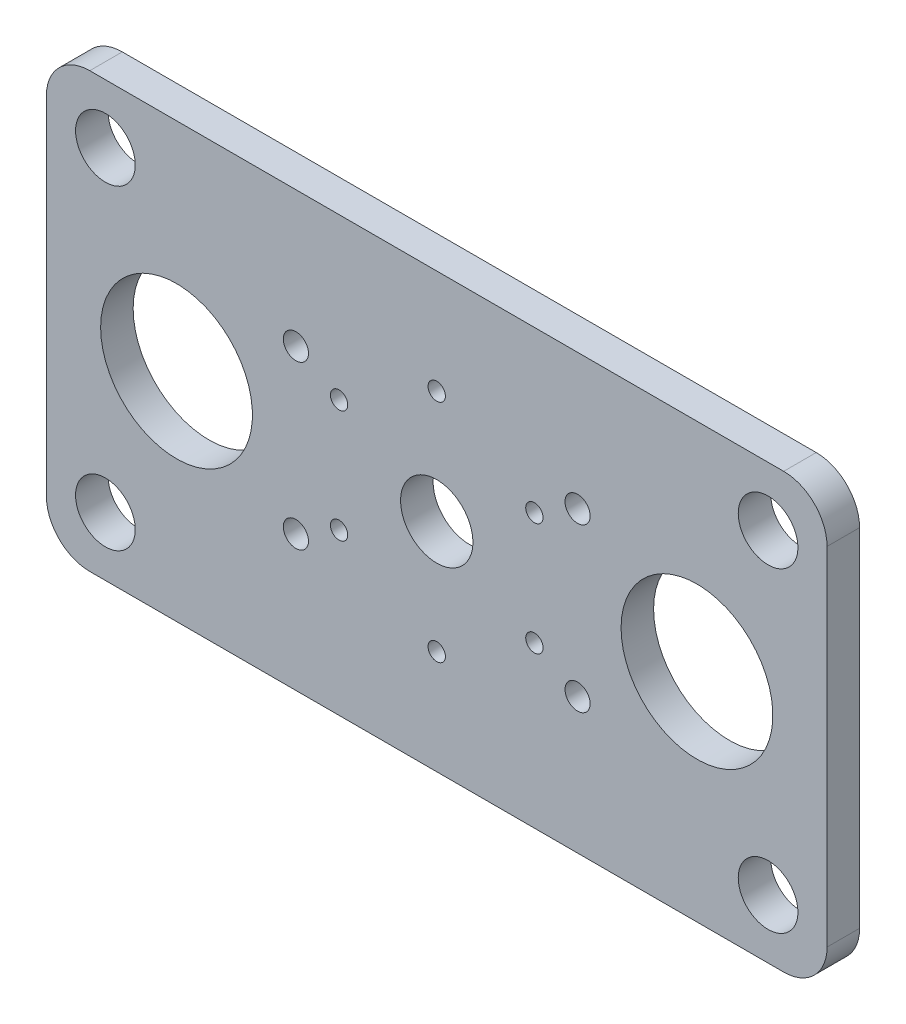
SolidWorks part; units mm, degrees
ref_plane "Front Plane" through (0, 0, 0) normal (0, 0, 1) x (1, 0, 0)
ref_plane "Top Plane" through (0, 0, 0) normal (0, 1, 0) x (1, 0, 0)
ref_plane "Right Plane" through (0, 0, 0) normal (1, 0, 0) x (0, 0, -1)
imported_body "Imported1"
sketch "Sketch1" plane through (0, 0, 4.7625) normal (0, 0, 1) x (1, 0, 0)
  circle A0 centre (0, 16.51) radius 1.27
  circle A1 centre (0, 0) radius 5.2959 construction
  circle A2 centre (14.2981, 8.255) radius 1.27
  circle A3 centre (14.2981, -8.255) radius 1.27
  circle A4 centre (0, -16.51) radius 1.27
  circle A5 centre (-14.2981, -8.255) radius 1.27
  circle A6 centre (-14.2981, 8.255) radius 1.27
  dimension "D1" = 2.54
  dimension "D2" = 16.51
  dimension "D3" = 6
extrude "Cut-Extrude1" cut sketch "Sketch1" against normal through all
